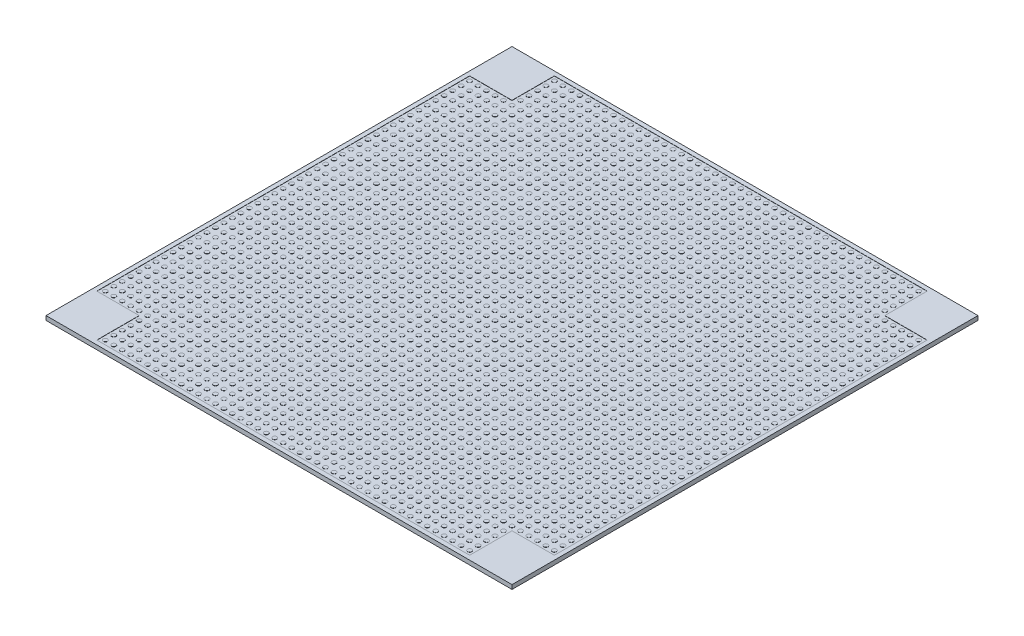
SolidWorks part; units mm, degrees
ref_plane "Front Plane" through (0, 0, 0) normal (0, 0, 1) x (1, 0, 0)
ref_plane "Top Plane" through (0, 0, 0) normal (0, 1, 0) x (1, 0, 0)
ref_plane "Right Plane" through (0, 0, 0) normal (1, 0, 0) x (0, 0, -1)
sketch "Sketch1" plane through (0, 0, 0) normal (0, 1, 0) x (1, 0, 0)
  line L1 (-110, 110) -> (110, 110)
  line L2 (-110, 110) -> (-110, -110)
  line L3 (-110, -110) -> (110, -110)
  line L4 (110, 110) -> (110, -110)
  line L5 (-110, 110) -> (110, -110) construction
  line L6 (-110, -110) -> (110, 110) construction
  point P0 (0, 0)
  dimension "D1" = 220
  dimension "D2" = 220
extrude "Boss-Extrude1" add sketch "Sketch1" along normal blind 1.9
sketch "Sketch2"
  dimension "D2" = 2
  dimension "D3" = 2
  dimension "D4" = 2
  dimension "D1" = 2
  dimension "D5" = 54
  dimension "D6" = 54
extrude "Boss-Extrude2" add sketch "Sketch2" along normal blind 0.1
sketch "Sketch3" plane through (0, 1.9, 0) normal (0, 1, 0) x (1, 0, 0)
  line L1 (-108, 108) -> (-88, 108)
  line L2 (-108, 108) -> (-108, 88)
  line L3 (-108, 88) -> (-88, 88)
  line L4 (-88, 108) -> (-88, 88)
  line L5 (0, 0) -> (0, 9.5422) construction
  line L6 (0, 9.5422) -> (0, 0) construction
  line L7 (0, 0) -> (11.4281, 0) construction
  line L8 (88, 108) -> (88, 88)
  line L9 (108, 88) -> (88, 88)
  line L10 (108, 108) -> (108, 88)
  line L11 (108, 108) -> (88, 108)
  line L12 (108, -108) -> (88, -108)
  line L13 (108, -108) -> (108, -88)
  line L14 (108, -88) -> (88, -88)
  line L15 (88, -108) -> (88, -88)
  line L16 (-88, -108) -> (-88, -88)
  line L17 (-108, -88) -> (-88, -88)
  line L18 (-108, -108) -> (-108, -88)
  line L19 (-108, -108) -> (-88, -108)
  dimension "D1" = 20
  dimension "D2" = 20
extrude "Boss-Extrude3" add sketch "Sketch3" along normal blind 0.1
sketch "Sketch4" plane through (0, 0, 0) normal (0, -1, 0) x (1, 0, 0)
  text T0 "Imaad Yameen"
extrude "Cut-Extrude1" cut sketch "Sketch4" against normal blind 0.5
